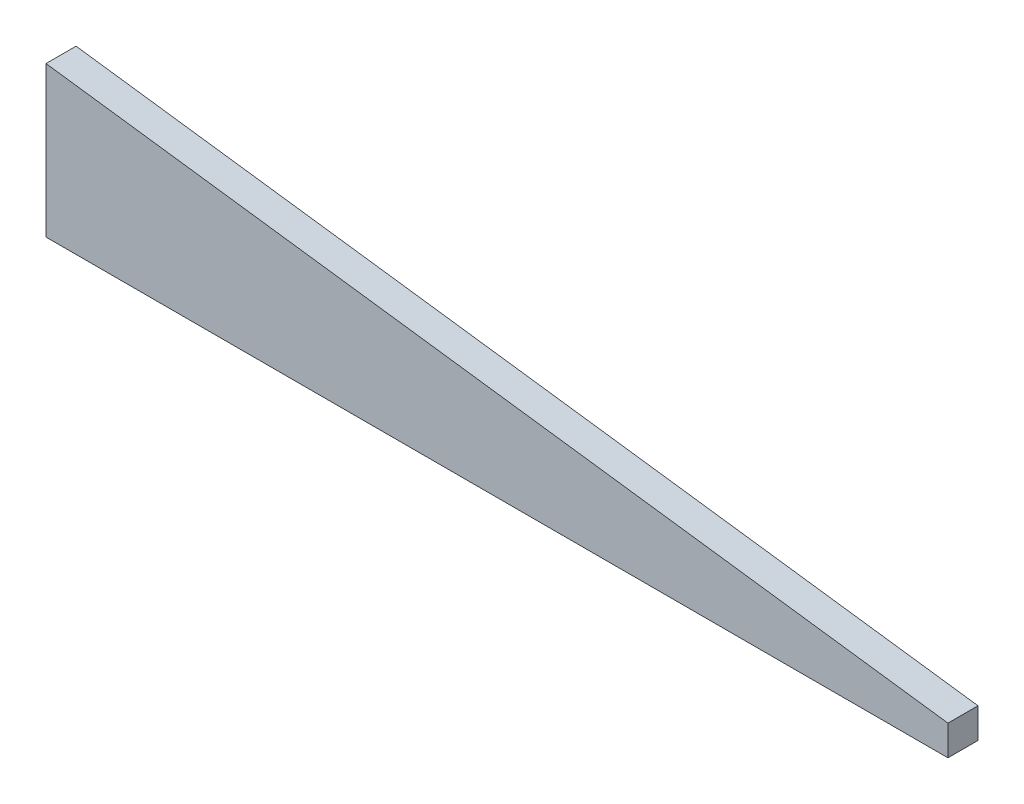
SolidWorks part; units mm, degrees
ref_plane "Plan de face" through (0, 0, 0) normal (0, 0, 1) x (1, 0, 0)
ref_plane "Plan de dessus" through (0, 0, 0) normal (0, 1, 0) x (1, 0, 0)
ref_plane "Plan de droite" through (0, 0, 0) normal (1, 0, 0) x (0, 0, -1)
sketch "Esquisse1" plane through (0, 0, 0) normal (0, 0, 1) x (1, 0, 0)
  line L0 (0, 0) -> (300, 0)
  line L1 (300, 0) -> (300, 10)
  line L2 (300, 10) -> (0, 50)
  line L3 (0, 50) -> (0, 0)
  dimension "D1" = 300
  dimension "D2" = 50
  dimension "D3" = 10
extrude "Boss.-Extru.1" add sketch "Esquisse1" along normal blind 10
sketch "Esquisse2" plane through (0, 0, 0) normal (0, -1, 0) x (1, 0, 0)
  line L0 (300, 5) -> (0, 5)
  line L1 (300, 10) -> (300, 0) construction
  line L2 (0, 10) -> (0, 0) construction
